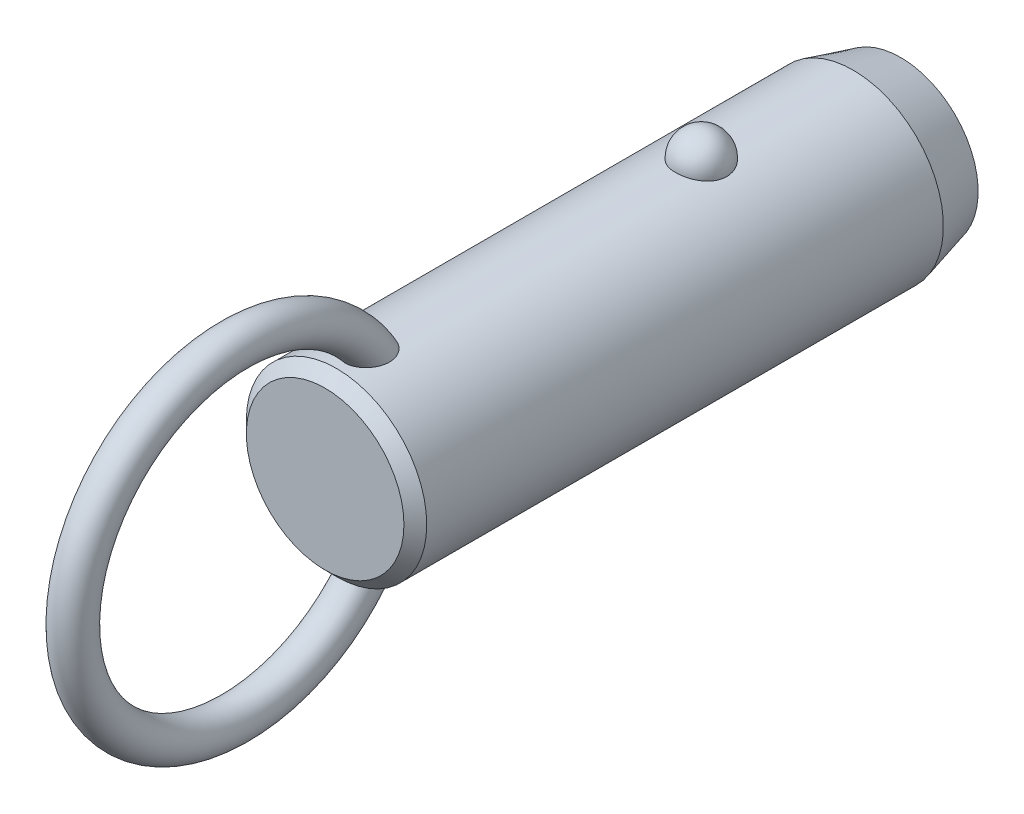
SolidWorks part; units mm, degrees
ref_plane "Front Plane" through (0, 0, 0) normal (0, 0, 1) x (1, 0, 0)
ref_plane "Top Plane" through (0, 0, 0) normal (0, 1, 0) x (1, 0, 0)
ref_plane "Right Plane" through (0, 0, 0) normal (1, 0, 0) x (0, 0, -1)
sketch "Sketch2" plane through (0, 0, 0) normal (0, 0, 1) x (1, 0, 0)
  circle A0 centre (0, 0) radius 9.5
  point P3 (0, 9.5)
  dimension "D1" = 19
extrude "Boss-Extrude1" add sketch "Sketch2" along normal blind 27.4
sketch "Sketch3" plane through (0, 0, 0) normal (0, 0, -1) x (-1, 0, 0)
  circle A0 centre (0, 0) radius 9.5
  dimension "D1" = 19
extrude "Boss-Extrude2" add sketch "Sketch3" along normal blind 23.7
chamfer "Chamfer1" distance 5 angle 15 1 edges at (-9.5, 0, -23.7)
sketch "Sketch12" plane through (0, 0, 0) normal (1, 0, 0) x (0, 0, -1)
  line L0 (-27.4, 9.5) -> (-27.4, -9.5) construction
  point P0 (-27.4, 0)
sketch "Sketch13" plane through (0, 0, 0) normal (1, 0, 0) x (0, 0, -1)
  circle A0 centre (-46.45, 0) radius 19.05
  point P2 (-27.4, 0)
  dimension "D1" = 38.1
sketch "Sketch14" plane through (0, 0, 0) normal (0, 1, 0) x (1, 0, 0)
  circle A0 centre (0, -29.4) radius 2
  point P2 (0, -27.4)
  dimension "D1" = 4
sweep "Sweep1" add profiles "Sketch14" path "Sketch13"
sketch "Sketch15" plane through (0, 0, 27.4) normal (0, 0, 1) x (1, 0, 0)
  circle A0 centre (0, 0) radius 9.5
  dimension "D1" = 19
extrude "Boss-Extrude3" add sketch "Sketch15" along normal blind 9.52
chamfer "Chamfer2" distance 1.2 angle 45 1 edges at (9.5, 0, 36.92)
sketch "Sketch18" plane through (0, 0, 0) normal (1, 0, 0) x (0, 0, -1)
  line L0 (18.7, 9.5) -> (-29.9378, 9.5) construction
  line L1 (2.7, 12.2) -> (2.7, 6.8)
  line L2 (-29.9378, -9.5) -> (18.7, -9.5) construction
  arc A0 (2.7, 12.2) -> (2.7, 6.8) centre (2.7, 9.5) ccw
  point P4 (0, 9.5)
  dimension "D1" = 21.7
revolve "Revolve1" add sketch "Sketch18" angle 360 about L1
